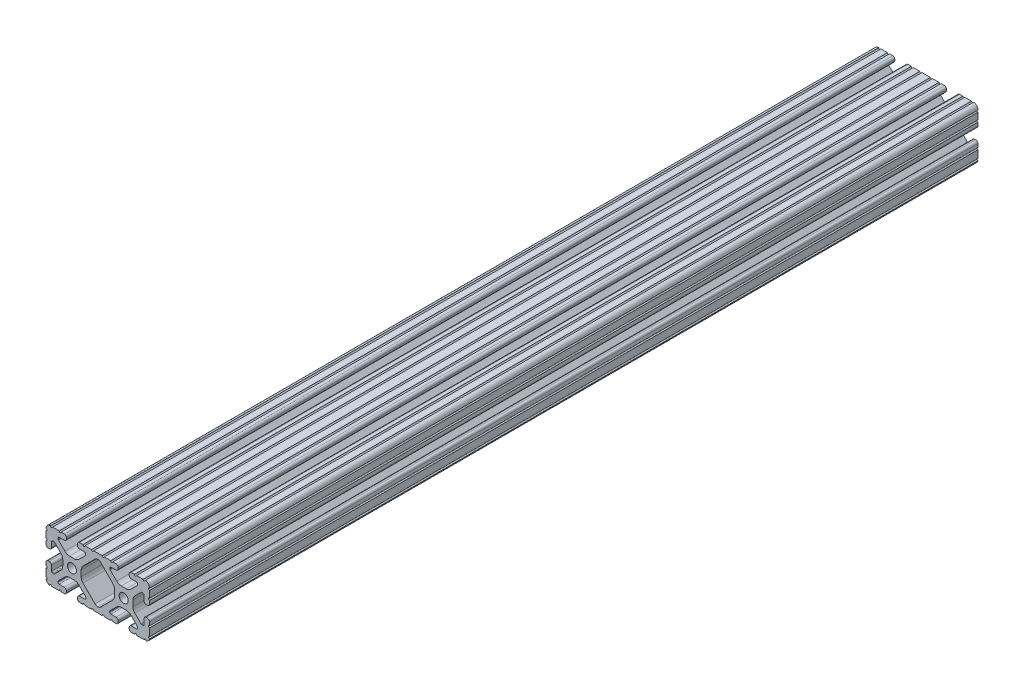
SolidWorks part; units mm, degrees
ref_plane "Front" through (0, 0, 0) normal (0, 0, 1) x (1, 0, 0)
ref_plane "Top" through (0, 0, 0) normal (0, 1, 0) x (1, 0, 0)
ref_plane "Right" through (0, 0, 0) normal (1, 0, 0) x (0, 0, -1)
sketch "Sketch1" plane through (0, 0, 0) normal (0, 0, 1) x (1, 0, 0)
  line L2 (30.3513, 26.5282) -> (39.1767, 35.3536)
  line L3 (40.5679, 38.7122) -> (40.5679, 42.8592)
  line L4 (39.1767, 46.2178) -> (30.3513, 55.0433)
  line L5 (26.1972, 55.0433) -> (17.3719, 46.2178)
  line L6 (15.9807, 42.8592) -> (15.9807, 38.7122)
  line L7 (17.3719, 35.3536) -> (26.1972, 26.5282)
  line L8 (37.19, 54.3201) -> (37.19, 54.8827)
  line L9 (38.079, 55.7717) -> (41.6855, 55.7717)
  line L10 (43.2603, 57.3465) -> (43.2603, 58.2825)
  line L11 (41.707, 59.8357) -> (39.2718, 59.8357)
  line L12 (37.7478, 59.8357) -> (32.9194, 59.8357)
  line L13 (31.3954, 59.8357) -> (25.1532, 59.8357)
  line L14 (23.6292, 59.8357) -> (18.8007, 59.8357)
  line L15 (17.2767, 59.8357) -> (14.8415, 59.8357)
  line L16 (13.2883, 58.2825) -> (13.2883, 57.3465)
  line L17 (14.8631, 55.7717) -> (18.4695, 55.7717)
  line L18 (19.3585, 54.8827) -> (19.3585, 54.3201)
  line L19 (19.0981, 53.6915) -> (14.4218, 49.0151)
  line L20 (11.0632, 47.6239) -> (7.3854, 47.6239)
  line L21 (4.0268, 49.0151) -> (-0.6496, 53.6915)
  line L22 (-0.91, 54.3201) -> (-0.91, 54.8827)
  line L23 (-0.021, 55.7717) -> (3.5855, 55.7717)
  line L24 (5.1603, 57.3465) -> (5.1603, 58.2663)
  line L25 (3.7154, 59.8357) -> (1.3285, 59.8357)
  line L26 (-0.1955, 59.8357) -> (-5.022, 59.8357)
  line L27 (-9.8257, 55.1609) -> (-9.8257, 50.3354)
  line L28 (-9.8257, 48.8114) -> (-9.8257, 46.4245)
  line L29 (-8.2509, 44.8497) -> (-7.3365, 44.8497)
  line L30 (-5.7617, 46.4245) -> (-5.7617, 50.1837)
  line L31 (-4.8727, 51.0727) -> (-4.1464, 51.0727)
  line L32 (-3.5178, 50.8123) -> (1.0767, 46.2178)
  line L33 (2.4679, 42.8592) -> (2.4679, 38.7122)
  line L34 (1.0767, 35.3536) -> (-3.5178, 30.7591)
  line L35 (-4.1464, 30.4987) -> (-4.8727, 30.4987)
  line L36 (-5.7617, 31.3877) -> (-5.7617, 35.1469)
  line L37 (-7.3365, 36.7217) -> (-8.2509, 36.7217)
  line L38 (-9.8257, 35.1469) -> (-9.8257, 32.76)
  line L39 (-9.8257, 31.236) -> (-9.8257, 25.7497)
  line L40 (-5.773, 21.7357) -> (-0.1955, 21.7357)
  line L41 (1.3285, 21.7357) -> (3.5855, 21.7357)
  line L42 (5.1603, 23.3105) -> (5.1603, 24.2249)
  line L43 (3.5855, 25.7997) -> (-0.1737, 25.7997)
  line L44 (-1.0627, 26.6887) -> (-1.0627, 27.0985)
  line L45 (-0.8023, 27.7272) -> (4.0268, 32.5563)
  line L46 (7.3854, 33.9475) -> (11.0632, 33.9475)
  line L47 (14.4218, 32.5563) -> (19.2509, 27.7272)
  line L48 (19.5113, 27.0985) -> (19.5113, 26.6887)
  line L49 (18.6223, 25.7997) -> (14.8631, 25.7997)
  line L50 (13.2883, 24.2249) -> (13.2883, 23.3105)
  line L51 (14.8631, 21.7357) -> (17.2767, 21.7357)
  line L52 (18.8007, 21.7357) -> (23.6292, 21.7357)
  line L53 (25.1532, 21.7357) -> (31.3954, 21.7357)
  line L54 (32.9194, 21.7357) -> (37.7478, 21.7357)
  line L55 (39.2718, 21.7357) -> (41.6855, 21.7357)
  line L56 (43.2603, 23.3105) -> (43.2603, 24.2249)
  line L57 (41.6855, 25.7997) -> (37.9263, 25.7997)
  line L58 (37.0373, 26.6887) -> (37.0373, 27.0985)
  line L59 (37.2977, 27.7272) -> (42.1268, 32.5563)
  line L60 (45.4854, 33.9475) -> (49.1632, 33.9475)
  line L61 (52.5218, 32.5563) -> (57.3509, 27.7272)
  line L62 (57.6113, 27.0985) -> (57.6113, 26.6887)
  line L63 (56.7223, 25.7997) -> (52.9631, 25.7997)
  line L64 (51.3883, 24.2249) -> (51.3883, 23.3105)
  line L65 (52.9631, 21.7357) -> (55.2201, 21.7357)
  line L66 (56.7441, 21.7357) -> (62.3216, 21.7357)
  line L67 (66.3743, 25.7497) -> (66.3743, 31.236)
  line L68 (66.3743, 32.76) -> (66.3743, 35.1469)
  line L69 (64.7995, 36.7217) -> (63.8851, 36.7217)
  line L70 (62.3103, 35.1469) -> (62.3103, 31.3877)
  line L71 (61.4213, 30.4987) -> (60.6949, 30.4987)
  line L72 (60.0663, 30.7591) -> (55.4719, 35.3536)
  line L73 (54.0807, 38.7122) -> (54.0807, 42.8592)
  line L74 (55.4719, 46.2178) -> (60.0663, 50.8123)
  line L75 (60.6949, 51.0727) -> (61.4213, 51.0727)
  line L76 (62.3103, 50.1837) -> (62.3103, 46.4245)
  line L77 (63.8851, 44.8497) -> (64.7995, 44.8497)
  line L78 (66.3743, 46.4245) -> (66.3743, 48.8114)
  line L79 (66.3743, 50.3354) -> (66.3743, 55.1609)
  line L80 (61.5705, 59.8357) -> (56.7441, 59.8357)
  line L81 (55.2201, 59.8357) -> (52.8332, 59.8357)
  line L82 (51.3883, 58.2663) -> (51.3883, 57.3465)
  line L83 (52.9631, 55.7717) -> (56.5695, 55.7717)
  line L84 (57.4585, 54.8827) -> (57.4585, 54.3201)
  line L85 (57.1981, 53.6915) -> (52.5218, 49.0151)
  line L86 (49.1632, 47.6239) -> (45.4854, 47.6239)
  line L87 (42.1268, 49.0151) -> (37.4504, 53.6915)
  arc A0 (39.1767, 35.3536) -> (40.5679, 38.7122) centre (35.8181, 38.7122) ccw
  arc A1 (30.3513, 55.0433) -> (28.2743, 55.8988) centre (28.2858, 52.9778) ccw
  arc A2 (28.2743, 55.8988) -> (26.1972, 55.0433) centre (28.2627, 52.9778) ccw
  arc A3 (17.3719, 46.2178) -> (15.9807, 42.8592) centre (20.7305, 42.8592) ccw
  arc A4 (15.9807, 38.7122) -> (17.3719, 35.3536) centre (20.7305, 38.7122) ccw
  arc A5 (26.1972, 26.5282) -> (28.2743, 25.6726) centre (28.2627, 28.5936) ccw
  arc A6 (28.2743, 25.6726) -> (30.3513, 26.5282) centre (28.2858, 28.5936) ccw
  circle A7 centre (47.3243, 40.7857) radius 3.3274
  circle A8 centre (9.2243, 40.7857) radius 3.3274
  arc A9 (40.5679, 42.8592) -> (39.1767, 46.2178) centre (35.8181, 42.8592) ccw
  arc A10 (38.079, 55.7717) -> (37.19, 54.8827) centre (38.079, 54.8827) ccw
  arc A11 (41.6855, 55.7717) -> (43.2603, 57.3465) centre (41.6855, 57.3465) ccw
  arc A12 (43.2603, 58.2825) -> (41.707, 59.8357) centre (41.707, 58.2825) ccw
  arc A13 (37.7478, 59.8357) -> (39.2718, 59.8357) centre (38.5098, 59.8357) ccw
  arc A14 (31.3954, 59.8357) -> (32.9194, 59.8357) centre (32.1574, 59.8357) ccw
  arc A15 (23.6292, 59.8357) -> (25.1532, 59.8357) centre (24.3912, 59.8357) ccw
  arc A16 (17.2767, 59.8357) -> (18.8007, 59.8357) centre (18.0387, 59.8357) ccw
  arc A17 (14.8415, 59.8357) -> (13.2883, 58.2825) centre (14.8415, 58.2825) ccw
  arc A18 (13.2883, 57.3465) -> (14.8631, 55.7717) centre (14.8631, 57.3465) ccw
  arc A19 (19.3585, 54.8827) -> (18.4695, 55.7717) centre (18.4695, 54.8827) ccw
  arc A20 (19.0981, 53.6915) -> (19.3585, 54.3201) centre (18.4695, 54.3201) ccw
  arc A21 (11.0632, 47.6239) -> (14.4218, 49.0151) centre (11.0632, 52.3737) ccw
  arc A22 (4.0268, 49.0151) -> (7.3854, 47.6239) centre (7.3854, 52.3737) ccw
  arc A23 (-0.91, 54.3201) -> (-0.6496, 53.6915) centre (-0.021, 54.3201) ccw
  arc A24 (-0.021, 55.7717) -> (-0.91, 54.8827) centre (-0.021, 54.8827) ccw
  arc A25 (3.5855, 55.7717) -> (5.1603, 57.3465) centre (3.5855, 57.3465) ccw
  arc A26 (5.1603, 58.2663) -> (3.7154, 59.8357) centre (3.5855, 58.2663) ccw
  arc A27 (-0.1955, 59.8357) -> (1.3285, 59.8357) centre (0.5665, 59.8357) ccw
  arc A28 (-6.5453, 59.8825) -> (-5.022, 59.8357) centre (-5.7836, 59.8591) ccw
  arc A29 (-6.5453, 59.8825) -> (-9.8633, 56.684) centre (-6.6287, 56.6488) ccw
  arc A30 (-9.8257, 55.1609) -> (-9.8633, 56.684) centre (-9.8257, 55.9229) ccw
  arc A31 (-9.8257, 48.8114) -> (-9.8257, 50.3354) centre (-9.8257, 49.5734) ccw
  arc A32 (-9.8257, 46.4245) -> (-8.2509, 44.8497) centre (-8.2509, 46.4245) ccw
  arc A33 (-7.3365, 44.8497) -> (-5.7617, 46.4245) centre (-7.3365, 46.4245) ccw
  arc A34 (-4.8727, 51.0727) -> (-5.7617, 50.1837) centre (-4.8727, 50.1837) ccw
  arc A35 (-3.5178, 50.8123) -> (-4.1464, 51.0727) centre (-4.1464, 50.1837) ccw
  arc A36 (2.4679, 42.8592) -> (1.0767, 46.2178) centre (-2.2819, 42.8592) ccw
  arc A37 (1.0767, 35.3536) -> (2.4679, 38.7122) centre (-2.2819, 38.7122) ccw
  arc A38 (-4.1464, 30.4987) -> (-3.5178, 30.7591) centre (-4.1464, 31.3877) ccw
  arc A39 (-5.7617, 31.3877) -> (-4.8727, 30.4987) centre (-4.8727, 31.3877) ccw
  arc A40 (-5.7617, 35.1469) -> (-7.3365, 36.7217) centre (-7.3365, 35.1469) ccw
  arc A41 (-8.2509, 36.7217) -> (-9.8257, 35.1469) centre (-8.2509, 35.1469) ccw
  arc A42 (-9.8257, 31.236) -> (-9.8257, 32.76) centre (-9.8257, 31.998) ccw
  arc A43 (-9.8257, 24.2257) -> (-9.8257, 25.7497) centre (-9.8257, 24.9877) ccw
  arc A44 (-9.8257, 24.2257) -> (-7.297, 21.7357) centre (-6.6712, 24.9002) ccw
  arc A45 (-5.773, 21.7357) -> (-7.297, 21.7357) centre (-6.535, 21.7357) ccw
  arc A46 (1.3285, 21.7357) -> (-0.1955, 21.7357) centre (0.5665, 21.7357) ccw
  arc A47 (3.5855, 21.7357) -> (5.1603, 23.3105) centre (3.5855, 23.3105) ccw
  arc A48 (5.1603, 24.2249) -> (3.5855, 25.7997) centre (3.5855, 24.2249) ccw
  arc A49 (-1.0627, 26.6887) -> (-0.1737, 25.7997) centre (-0.1737, 26.6887) ccw
  arc A50 (-0.8023, 27.7272) -> (-1.0627, 27.0985) centre (-0.1737, 27.0985) ccw
  arc A51 (7.3854, 33.9475) -> (4.0268, 32.5563) centre (7.3854, 29.1977) ccw
  arc A52 (14.4218, 32.5563) -> (11.0632, 33.9475) centre (11.0632, 29.1977) ccw
  arc A53 (19.5113, 27.0985) -> (19.2509, 27.7272) centre (18.6223, 27.0985) ccw
  arc A54 (18.6223, 25.7997) -> (19.5113, 26.6887) centre (18.6223, 26.6887) ccw
  arc A55 (14.8631, 25.7997) -> (13.2883, 24.2249) centre (14.8631, 24.2249) ccw
  arc A56 (13.2883, 23.3105) -> (14.8631, 21.7357) centre (14.8631, 23.3105) ccw
  arc A57 (18.8007, 21.7357) -> (17.2767, 21.7357) centre (18.0387, 21.7357) ccw
  arc A58 (25.1532, 21.7357) -> (23.6292, 21.7357) centre (24.3912, 21.7357) ccw
  arc A59 (32.9194, 21.7357) -> (31.3954, 21.7357) centre (32.1574, 21.7357) ccw
  arc A60 (39.2718, 21.7357) -> (37.7478, 21.7357) centre (38.5098, 21.7357) ccw
  arc A61 (41.6855, 21.7357) -> (43.2603, 23.3105) centre (41.6855, 23.3105) ccw
  arc A62 (43.2603, 24.2249) -> (41.6855, 25.7997) centre (41.6855, 24.2249) ccw
  arc A63 (37.0373, 26.6887) -> (37.9263, 25.7997) centre (37.9263, 26.6887) ccw
  arc A64 (37.2977, 27.7272) -> (37.0373, 27.0985) centre (37.9263, 27.0985) ccw
  arc A65 (45.4854, 33.9475) -> (42.1268, 32.5563) centre (45.4854, 29.1977) ccw
  arc A66 (52.5218, 32.5563) -> (49.1632, 33.9475) centre (49.1632, 29.1977) ccw
  arc A67 (57.6113, 27.0985) -> (57.3509, 27.7272) centre (56.7223, 27.0985) ccw
  arc A68 (56.7223, 25.7997) -> (57.6113, 26.6887) centre (56.7223, 26.6887) ccw
  arc A69 (52.9631, 25.7997) -> (51.3883, 24.2249) centre (52.9631, 24.2249) ccw
  arc A70 (51.3883, 23.3105) -> (52.9631, 21.7357) centre (52.9631, 23.3105) ccw
  arc A71 (56.7441, 21.7357) -> (55.2201, 21.7357) centre (55.9821, 21.7357) ccw
  arc A72 (63.8456, 21.7357) -> (62.3216, 21.7357) centre (63.0836, 21.7357) ccw
  arc A73 (63.8456, 21.7357) -> (66.3743, 24.2257) centre (63.2122, 24.9079) ccw
  arc A74 (66.3743, 25.7497) -> (66.3743, 24.2257) centre (66.3743, 24.9877) ccw
  arc A75 (66.3743, 32.76) -> (66.3743, 31.236) centre (66.3743, 31.998) ccw
  arc A76 (66.3743, 35.1469) -> (64.7995, 36.7217) centre (64.7995, 35.1469) ccw
  arc A77 (63.8851, 36.7217) -> (62.3103, 35.1469) centre (63.8851, 35.1469) ccw
  arc A78 (61.4213, 30.4987) -> (62.3103, 31.3877) centre (61.4213, 31.3877) ccw
  arc A79 (60.0663, 30.7591) -> (60.6949, 30.4987) centre (60.6949, 31.3877) ccw
  arc A80 (54.0807, 38.7122) -> (55.4719, 35.3536) centre (58.8305, 38.7122) ccw
  arc A81 (55.4719, 46.2178) -> (54.0807, 42.8592) centre (58.8305, 42.8592) ccw
  arc A82 (60.6949, 51.0727) -> (60.0663, 50.8123) centre (60.6949, 50.1837) ccw
  arc A83 (62.3103, 50.1837) -> (61.4213, 51.0727) centre (61.4213, 50.1837) ccw
  arc A84 (62.3103, 46.4245) -> (63.8851, 44.8497) centre (63.8851, 46.4245) ccw
  arc A85 (64.7995, 44.8497) -> (66.3743, 46.4245) centre (64.7995, 46.4245) ccw
  arc A86 (66.3743, 50.3354) -> (66.3743, 48.8114) centre (66.3743, 49.5734) ccw
  arc A87 (66.4119, 56.684) -> (66.3743, 55.1609) centre (66.3743, 55.9229) ccw
  arc A88 (66.4119, 56.684) -> (63.0938, 59.8825) centre (63.1773, 56.6488) ccw
  arc A89 (61.5705, 59.8357) -> (63.0938, 59.8825) centre (62.3322, 59.8591) ccw
  arc A90 (55.2201, 59.8357) -> (56.7441, 59.8357) centre (55.9821, 59.8357) ccw
  arc A91 (52.8332, 59.8357) -> (51.3883, 58.2663) centre (52.9631, 58.2663) ccw
  arc A92 (51.3883, 57.3465) -> (52.9631, 55.7717) centre (52.9631, 57.3465) ccw
  arc A93 (57.4585, 54.8827) -> (56.5695, 55.7717) centre (56.5695, 54.8827) ccw
  arc A94 (57.1981, 53.6915) -> (57.4585, 54.3201) centre (56.5695, 54.3201) ccw
  arc A95 (49.1632, 47.6239) -> (52.5218, 49.0151) centre (49.1632, 52.3737) ccw
  arc A96 (42.1268, 49.0151) -> (45.4854, 47.6239) centre (45.4854, 52.3737) ccw
  arc A97 (37.19, 54.3201) -> (37.4504, 53.6915) centre (38.079, 54.3201) ccw
extrude "Extrude1" add sketch "Sketch1" along normal blind 609.6
sketch "Sketch2" plane through (0, 21.7357, 0) normal (0, -1, 0) x (1, 0, 0)
  line L0 (-9.8257, 609.6) -> (-9.8257, 0) construction
  line L1 (-9.8257, 609.6) -> (-9.8257, 0) construction
  line L2 (7.3854, 609.6) -> (11.0632, 609.6) construction
  circle A0 centre (9.2243, 323.85) radius 3.5719
  circle A1 centre (9.2243, 285.75) radius 3.5719
  dimension "D1" = 7.1437
  dimension "D2" = 7.1437
  dimension "D3" = 19.05
  dimension "D4" = 19.05
  dimension "D5" = 38.1
  dimension "D6" = 285.75
extrude "Extrude2" cut sketch "Sketch2" against normal blind 38.1
sketch "Sketch3" plane through (66.3743, 0, 0) normal (1, 0, 0) x (0, 0, -1)
  line L0 (0, 38.7122) -> (0, 42.8592) construction
  line L1 (0, 59.8836) -> (-609.6, 59.8836) construction
  line L2 (-609.6, 38.7122) -> (-609.6, 42.8592) construction
  line L3 (-609.6, 21.7357) -> (0, 21.7357) construction
  circle A0 centre (-19.05, 40.8336) radius 3.5719
  circle A1 centre (-57.15, 40.8336) radius 3.5719
  circle A2 centre (-590.55, 40.8336) radius 3.5719
  circle A3 centre (-552.45, 40.7857) radius 3.5719
  point P4 (0, 40.7857)
  point P13 (-609.6, 40.7857)
  dimension "D1" = 7.1437
  dimension "D2" = 7.1437
  dimension "D7" = 7.1437
  dimension "D8" = 7.1437
  dimension "D3" = 19.05
  dimension "D4" = 19.05
  dimension "D5" = 19.05
  dimension "D6" = 38.1
  dimension "D9" = 19.05
  dimension "D10" = 19.05
  dimension "D11" = 19.05
  dimension "D12" = 38.1
extrude "Extrude3" cut sketch "Sketch3" against normal blind 76.2
